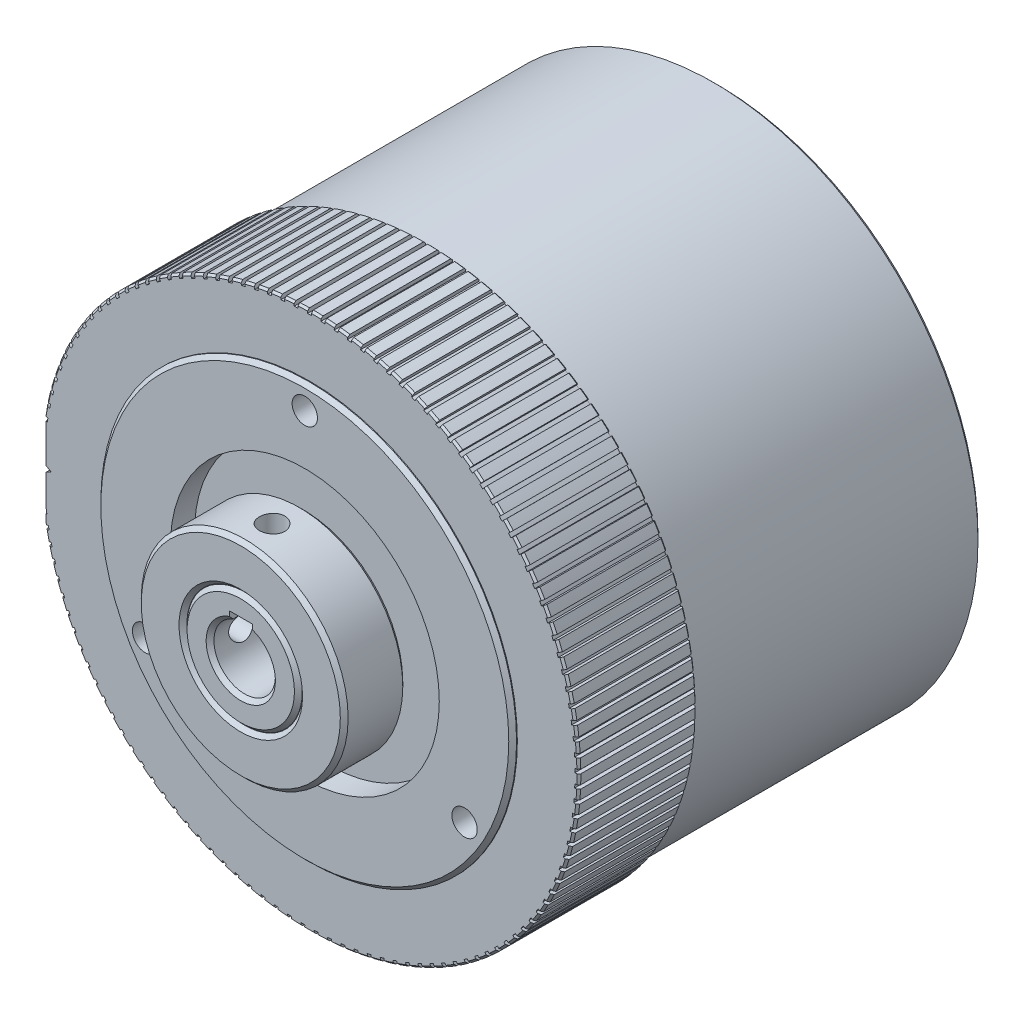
SolidWorks part; units mm, degrees
ref_plane "Front Plane" through (0, 0, 0) normal (0, 0, 1) x (1, 0, 0)
ref_plane "Top Plane" through (0, 0, 0) normal (0, 1, 0) x (1, 0, 0)
ref_plane "Right Plane" through (0, 0, 0) normal (1, 0, 0) x (0, 0, -1)
sketch "Sketch8" plane through (0, 0, 0) normal (1, 0, 0) x (0, 0, -1)
  line L0 (8.3337, 26.543) -> (8.3337, 17.5006)
  line L1 (0, 4.508) -> (0, 6.985)
  line L2 (55, 0) -> (-55, 0) construction
  line L3 (8.3337, 17.5006) -> (11.4833, 17.5006)
  line L4 (0, 6.985) -> (0.508, 7.493)
  line L5 (0, 55) -> (0, -55) construction
  line L6 (0.508, 7.493) -> (0.508, 7.5336)
  line L7 (24.0563, 35.052) -> (24.3103, 34.798)
  line L8 (0.508, 7.5336) -> (0.0025, 8.0391)
  line L9 (11.4833, 17.5006) -> (11.4833, 7.493)
  line L10 (0.0025, 8.0391) -> (0.0025, 12.954)
  line L11 (0.0025, 12.954) -> (0.5105, 13.462)
  line L12 (0.508, 4) -> (0, 4.508)
  line L13 (0.5105, 13.462) -> (7.6225, 13.462)
  line L14 (57.9882, 4.508) -> (57.4802, 4)
  line L15 (7.6225, 13.462) -> (8.1305, 12.954)
  line L17 (8.1305, 12.954) -> (8.1305, 8.0391)
  line L19 (8.1305, 8.0391) -> (7.6225, 7.5311)
  line L21 (7.6225, 7.5311) -> (7.6225, 7.493)
  line L22 (7.6225, 7.493) -> (11.4833, 7.493)
  line L26 (8.3337, 26.543) -> (8.8417, 27.051)
  line L28 (8.8417, 27.051) -> (8.9441, 27.051)
  line L30 (8.9441, 27.051) -> (8.9441, 34.798)
  line L31 (8.9441, 34.798) -> (9.1981, 35.052)
  line L32 (9.1981, 35.052) -> (24.0563, 35.052)
  line L34 (24.3103, 34.798) -> (24.3103, 34.417)
  line L35 (24.3103, 34.417) -> (61.5213, 34.417)
  line L37 (61.5213, 34.417) -> (62.0293, 33.909)
  line L39 (62.0293, 33.909) -> (62.0293, 17.5006)
  line L41 (62.0293, 17.5006) -> (58.8543, 17.5006)
  line L43 (58.8543, 17.5006) -> (58.8543, 16.2814)
  line L46 (58.8543, 16.2814) -> (57.5335, 16.2814)
  line L48 (57.5335, 16.2814) -> (57.5335, 7.4397)
  line L50 (57.5335, 7.4397) -> (57.9882, 6.985)
  line L52 (57.9882, 6.985) -> (57.9882, 4.508)
  line L54 (57.4802, 4) -> (0.508, 4)
  line L55 (3.852, 0) -> (49.0474, 0) construction
  point P0 (0, 4)
  point P52 (24.3103, 35.052)
  point P67 (57.9882, 4)
  dimension "D1" = 8
  dimension "D2" = 13.97
  dimension "D3" = 26.924
  dimension "D4" = 45
  dimension "D5" = 13.97
  dimension "D6" = 45
  dimension "D7" = 16.0782
  dimension "D8" = 45
  dimension "D9" = 14.986
  dimension "D10" = 32.5628
  dimension "D11" = 35.0012
  dimension "D12" = 68.834
  dimension "D13" = 54.102
  dimension "D14" = 0.508
  dimension "D15" = 25.908
  dimension "D16" = 70.104
  dimension "D17" = 45
  dimension "D18" = 8.128
  dimension "D19" = 57.9882
  dimension "D20" = 0.508
  dimension "D21" = 15.1122
  dimension "D22" = 37.719
  dimension "D23" = 7.112
  dimension "D24" = 3.8608
  dimension "D25" = 35.0012
  dimension "D26" = 37.211
  dimension "D27" = 45
  dimension "D28" = 0.508
  dimension "D29" = 62.0268
  dimension "D30" = 3.175
  dimension "D31" = 1.3208
  dimension "D32" = 0.4547
  dimension "D33" = 45
  dimension "D34" = 3.1496
  dimension "D35" = 0.254
  dimension "D36" = 45
revolve "Revolve2" add sketch "Sketch8" angle 360 about L55
ref_plane "Plane1" through (0, 13.462, 0) normal (0, 1, 0) x (-1, 0, 0)
hole_wizard "M4x0.7 Tapped Hole1" positions "Sketch10" profile "Sketch9" tap size "M4x0.7" standard "Ansi Metric"
sketch "Sketch10" plane through (0, 13.462, 0) normal (0, 1, 0) x (-1, 0, 0)
  line L0 (0, -0.0025) -> (0, -8.1305) construction
  line L1 (12.954, -0.0025) -> (-12.954, -0.0025) construction
  line L2 (-12.954, -8.1305) -> (12.954, -8.1305) construction
  point P11 (0, -4.0665)
sketch "Sketch9" plane through (0, 13.462, -4.0665) normal (1, 0, 0) x (0, 0, 1)
  line L0 (0, 0) -> (0, 26.924)
  line L1 (0, 26.924) -> (1.65, 26.924)
  line L2 (1.65, 26.924) -> (1.65, 0)
  line L5 (1.65, 0) -> (0, 0)
  line L11 (0, -6.35) -> (0, 107.95) construction
  dimension "Thru Tap Drill Dia." = 3.3
  dimension "Thru Tap Drill Depth" = 26.924
pattern_circular "CirPattern1" count 2 over 90 about axis through (0, 0, -0.5105) along (0, 0, 1) of "M4x0.7 Tapped Hole1"
sketch "Sketch11" plane through (0, 0, -8.9441) normal (0, 0, 1) x (1, 0, 0)
  line L0 (0, 0) -> (0, 35.052) construction
  line L2 (-0.254, 35.814) -> (0.254, 35.814)
  line L3 (-0.254, 35.814) -> (-0.254, 34.544)
  line L4 (-0.254, 34.544) -> (0.254, 34.544)
  line L5 (0.254, 35.814) -> (0.254, 34.544)
  line L6 (-0.254, 35.814) -> (0.254, 34.544) construction
  line L7 (-0.254, 34.544) -> (0.254, 35.814) construction
  circle A0 centre (0, 0) radius 35.052 construction
  point P6 (0, 35.179)
  dimension "D1" = 0.508
  dimension "D2" = 1.27
  dimension "D3" = 34.544
extrude "Cut-Extrude1" cut sketch "Sketch11" against normal up to next
pattern_circular "CirPattern2" count 125 over 360 about axis through (0, 0, 0) along (0, 0, 1) of "Cut-Extrude1"
hole_wizard "M4x0.7 Tapped Hole2" positions "Sketch13" profile "Sketch12" tap size "M4x0.7" standard "Ansi Metric"
sketch "Sketch13" plane through (0, 0, -8.3337) normal (0, 0, 1) x (1, 0, 0)
  line L0 (0, 0) -> (0, 24.003) construction
  line L3 (0, 0) -> (20.7872, -12.0015) construction
  line L6 (0, 0) -> (-20.7872, -12.0015) construction
  circle A0 centre (0, 0) radius 24.003
  point P0 (0, 24.003)
  point P1 (20.7872, -12.0015)
  point P3 (-20.7872, -12.0015)
  dimension "D1" = 48.006
  dimension "D2" = 120
  dimension "D3" = 120
sketch "Sketch12" plane through (0, 24.003, -8.3337) normal (1, 0, 0) x (0, -1, 0)
  line L0 (0, 0) -> (0, 12.9294)
  line L1 (0, 12.9294) -> (1.65, 11.938)
  line L2 (1.65, 11.938) -> (1.65, 0)
  line L5 (1.65, 0) -> (0, 0)
  line L10 (0, 12.9294) -> (-1.65, 11.938) construction
  line L11 (0, -6.35) -> (0, 107.95) construction
  dimension "Tap Drill Dia." = 3.3
  dimension "Tap Drill Depth" = 11.938
  dimension "Drill Angle" = 118
ref_plane "Plane2" through (0, 0, -35.1815) normal (0, 0, 1) x (1, 0, 0)
mirror "Mirror1" about plane through (0, 0, -35.1815) normal (0, 0, 1) of "M4x0.7 Tapped Hole2"
sketch "Sketch14" plane through (0, 0, -8.9441) normal (0, 0, 1) x (1, 0, 0)
  line L0 (-40.64, 0) -> (-34.29, 0) construction
  line L1 (-40.64, 12.7) -> (-34.29, 12.7)
  line L2 (-40.64, 12.7) -> (-40.64, -12.7)
  line L3 (-40.64, -12.7) -> (-34.29, -12.7)
  line L4 (-34.29, 12.7) -> (-34.29, 0.381)
  line L5 (-34.29, 0.381) -> (-33.6301, 0)
  line L6 (-33.6301, 0) -> (-34.29, -0.381)
  line L7 (-34.29, -0.381) -> (-34.29, -12.7)
  dimension "D1" = 34.29
  dimension "D2" = 6.35
  dimension "D3" = 12.7
  dimension "D4" = 25.4
  dimension "D5" = 60
  dimension "D6" = 0.762
extrude "Cut-Extrude2" cut sketch "Sketch14" against normal up to surface (15.3662 mm away)
sketch "Sketch15" plane through (0, 0, 0) normal (0, 0, 1) x (1, 0, 0)
  line L0 (0, 0) -> (0, 13.462) construction
  line L2 (-1.4986, 4.89) -> (1.4986, 4.89)
  line L3 (-1.4986, 4.89) -> (-1.4986, 1.27)
  line L4 (-1.4986, 1.27) -> (1.4986, 1.27)
  line L5 (1.4986, 4.89) -> (1.4986, 1.27)
  line L6 (-1.4986, 4.89) -> (1.4986, 1.27) construction
  line L7 (-1.4986, 1.27) -> (1.4986, 4.89) construction
  circle A0 centre (0, 0) radius 13.462 construction
  circle A3 centre (0, 0) radius 4.508 construction
  point P6 (0, 3.08)
  dimension "D1" = 2.9972
  dimension "D2" = 9.398
  dimension "D3" = 1.27
extrude "Cut-Extrude3" cut sketch "Sketch15" against normal through all
